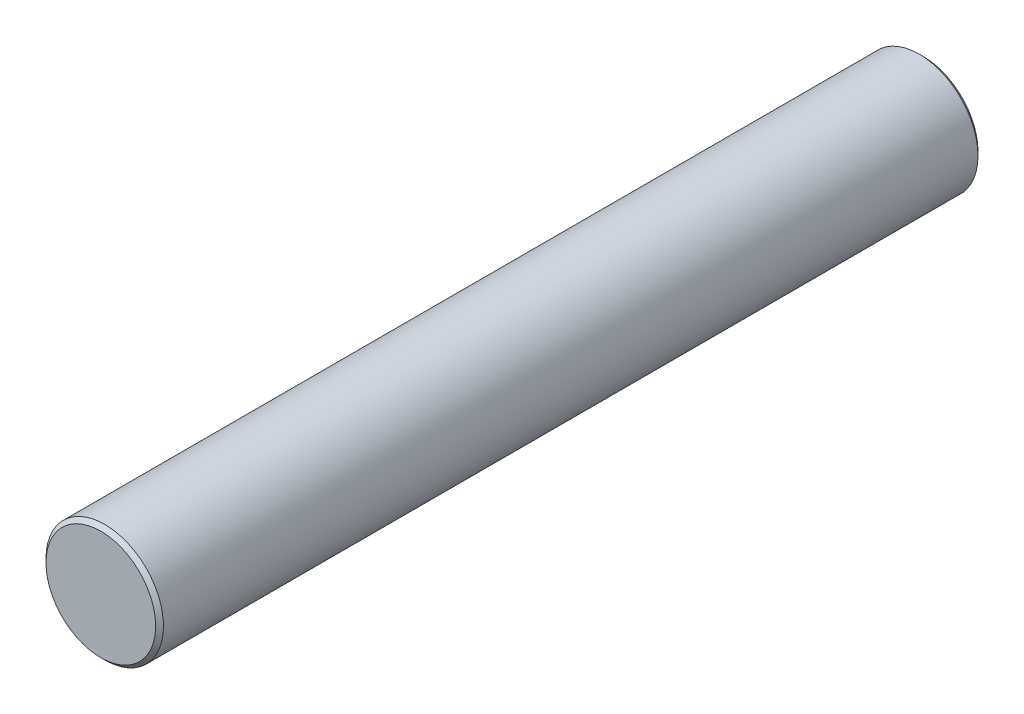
SolidWorks part; units mm, degrees
ref_plane "Front Plane" through (0, 0, 0) normal (0, 0, 1) x (1, 0, 0)
ref_plane "Top Plane" through (0, 0, 0) normal (0, 1, 0) x (1, 0, 0)
ref_plane "Right Plane" through (0, 0, 0) normal (1, 0, 0) x (0, 0, -1)
sketch "Sketch1" plane through (0, 0, 0) normal (0, 0, 1) x (1, 0, 0)
  circle A0 centre (0, 0) radius 1.5
extrude "Boss-Extrude1" add sketch "Sketch1" along normal blind 21
chamfer "Chamfer1" distance 0.1 angle 45 2 edges at (1.5, 0, 0) (1.5, 0, 21)
